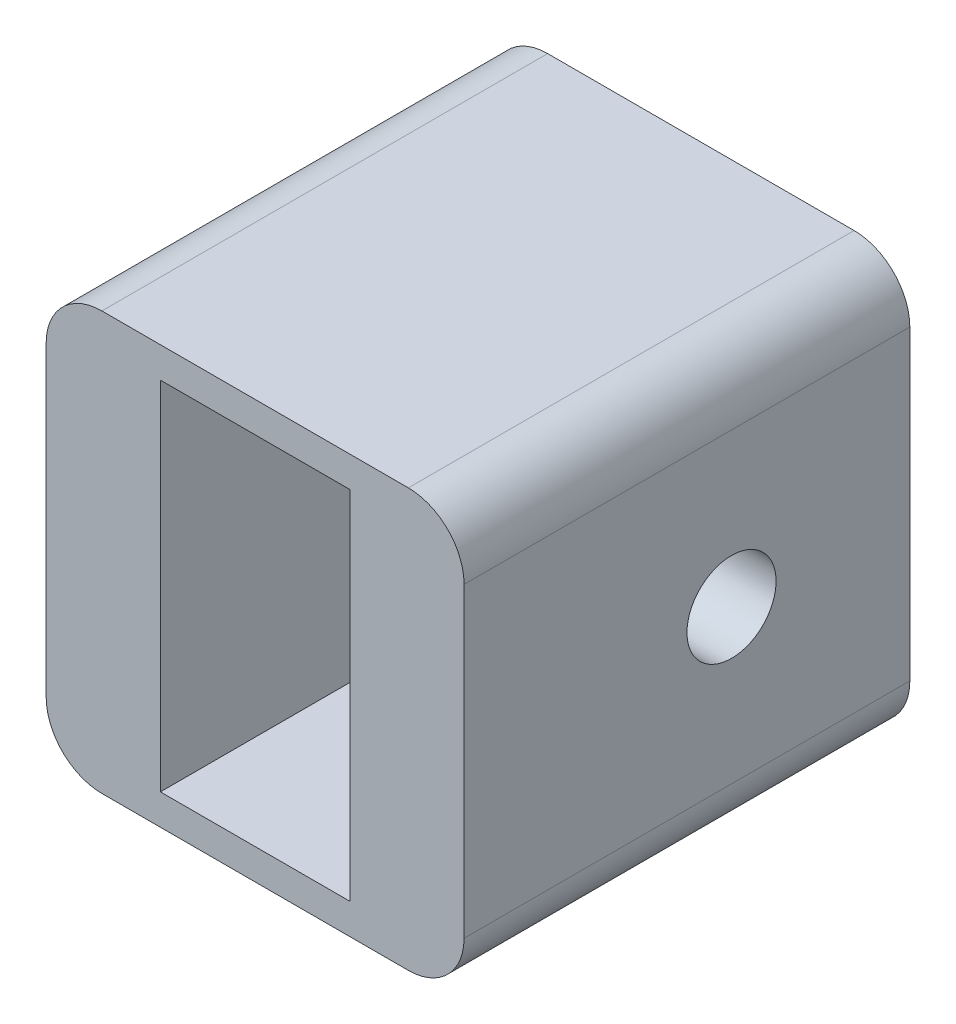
SolidWorks part; units mm, degrees
ref_plane "Plan1" through (0, 0, 0) normal (0, 0, 1) x (1, 0, 0)
ref_plane "Plan2" through (0, 0, 0) normal (0, 1, 0) x (1, 0, 0)
ref_plane "Plan3" through (0, 0, 0) normal (1, 0, 0) x (0, 0, -1)
sketch "Esquisse1" plane through (0, 0, 0) normal (0, 0, 1) x (1, 0, 0)
  line L1 (-27.5, 37.5) -> (27.5, 37.5)
  line L2 (-37.5, 27.5) -> (-37.5, -27.5)
  line L3 (-27.5, -37.5) -> (27.5, -37.5)
  line L4 (37.5, 27.5) -> (37.5, -27.5)
  arc A0 (-37.5, 27.5) -> (-27.5, 37.5) centre (-27.5, 27.5) cw
  arc A1 (-27.5, -37.5) -> (-37.5, -27.5) centre (-27.5, -27.5) cw
  arc A2 (37.5, -27.5) -> (27.5, -37.5) centre (27.5, -27.5) cw
  arc A3 (27.5, 37.5) -> (37.5, 27.5) centre (27.5, 27.5) cw
  dimension "D5" = 10
  dimension "D1" = 37.5
  dimension "D2" = 75
  dimension "D3" = 37.5
  dimension "D4" = 75
extrude "Base-Extrusion" add sketch "Esquisse1" along normal blind 80
sketch "Esquisse2" plane through (37.5, 0, 0) normal (1, 0, 0) x (0, 0, -1)
  line L0 (-80, -27.5) -> (-80, 27.5) construction
  circle A0 centre (-32, 0) radius 8
  dimension "D2" = 16
  dimension "D1" = 48
extrude "Enlèv. mat.-Extru.1" cut sketch "Esquisse2" against normal through all
sketch "Esquisse3" plane through (0, 0, 80) normal (0, 0, 1) x (1, 0, 0)
  line L1 (-17, 32) -> (17, 32)
  line L2 (-17, 32) -> (-17, -32)
  line L3 (-17, -32) -> (17, -32)
  line L4 (17, 32) -> (17, -32)
  dimension "D1" = 17
  dimension "D2" = 34
  dimension "D3" = 32
  dimension "D4" = 32
extrude "Enlèv. mat.-Extru.2" cut sketch "Esquisse3" against normal through all
